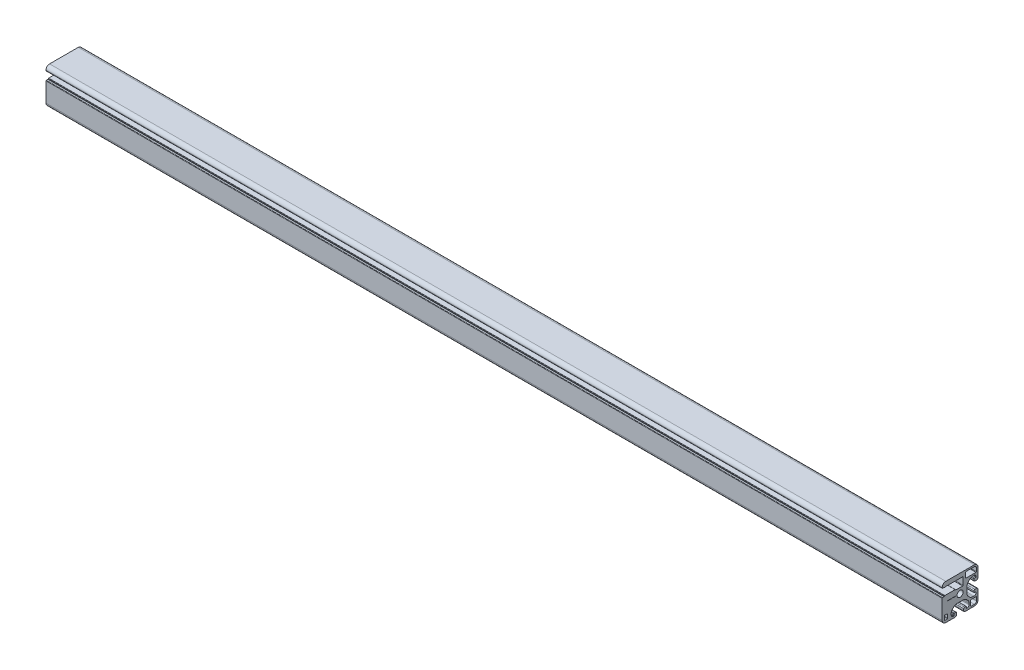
SolidWorks part; units mm, degrees
ref_plane "Ebene vorne" through (0, 0, 0) normal (0, 0, 1) x (1, 0, 0)
ref_plane "Ebene oben" through (0, 0, 0) normal (0, 1, 0) x (1, 0, 0)
ref_plane "Ebene rechts" through (0, 0, 0) normal (1, 0, 0) x (0, 0, -1)
sketch "Skizze1" plane through (0, 0, 0) normal (0, 1, 0) x (1, 0, 0)
  line L0 (0, 0) -> (1000, 0)
  dimension "D1" = 1000
other "Strukturbauteil1"
ref_plane "Ebene1" through (0, 0, 0) normal (1, 0, 0) x (0, 0, -1)
sketch "Model" plane through (0, 0, 0) normal (1, 0, 0) x (0, 0, -1)
  line L0 (-19.97, 15.976) -> (-19.97, 15.4768)
  line L1 (-19.97, 5.4918) -> (-19.97, -15.976)
  line L2 (-15.976, -19.97) -> (-5.4918, -19.97)
  line L3 (5.4918, -19.97) -> (15.976, -19.97)
  line L4 (-17.3739, -16.675) -> (-17.3739, -11.9325)
  line L5 (-17.2741, 6.4399) -> (-17.2741, -11.4601)
  line L6 (12.2816, -18.1727) -> (15.976, -18.1727)
  line L7 (-14.3784, -17.1742) -> (-16.8747, -17.1742)
  line L8 (6.4903, -15.4768) -> (4.9925, -15.4768)
  line L9 (-4.9925, -15.4768) -> (-6.4903, -15.4768)
  line L10 (-13.979, -11.4601) -> (-13.979, -0.0504)
  line L11 (-13.8792, -0.4993) -> (-13.8792, -11.4601)
  line L12 (-16.9745, -12.2321) -> (-14.2786, -12.2321)
  line L13 (17.6735, -11.7823) -> (12.2816, -11.7823)
  line L14 (-9.985, -15.4768) -> (-9.985, -14.1711)
  line L15 (15.4768, -9.985) -> (14.1711, -9.985)
  line L16 (-3.5523, -7.7384) -> (3.5523, -7.7384)
  line L17 (-6.9895, -15.976) -> (-6.9895, -17.4738)
  line L18 (15.976, -6.9895) -> (17.4738, -6.9895)
  line L19 (-5.2921, 0.5487) -> (-5.2921, 6.4399)
  line L20 (-4.9925, 5.4918) -> (-4.9925, 0.4993)
  line L21 (-3.994, -18.4723) -> (-3.994, -16.4753)
  line L22 (18.4723, -3.994) -> (16.4753, -3.994)
  line L23 (-5.4918, 0) -> (-13.3799, 0)
  line L24 (-13.6795, 0.2492) -> (-5.5916, 0.2492)
  line L25 (7.0825, -9.2006) -> (8.5227, -10.6409)
  line L26 (-8.5227, -10.6409) -> (-7.0825, -9.2006)
  line L27 (9.2006, 7.0825) -> (10.6409, 8.5227)
  line L28 (10.6409, -8.5227) -> (9.2006, -7.0825)
  line L29 (3.2951, 14.4783) -> (3.2951, 6.4903)
  line L30 (3.994, -16.4753) -> (3.994, -18.4723)
  line L31 (16.4753, 3.994) -> (18.4723, 3.994)
  line L32 (6.2906, 17.6735) -> (6.2906, 12.2816)
  line L33 (6.9895, -17.4738) -> (6.9895, -15.976)
  line L34 (7.7384, -3.5523) -> (7.7384, 3.5523)
  line L35 (2.7958, 5.991) -> (-4.4933, 5.991)
  line L36 (-17.8732, 5.991) -> (-19.4708, 5.991)
  line L37 (-5.5916, 6.7394) -> (-16.9745, 6.7394)
  line L38 (17.4738, 6.9895) -> (15.976, 6.9895)
  line L39 (9.985, -14.1711) -> (9.985, -15.4768)
  line L40 (14.1711, 9.985) -> (15.4768, 9.985)
  line L41 (11.7823, -12.2816) -> (11.7823, -17.6735)
  line L42 (6.7898, 11.7823) -> (17.6735, 11.7823)
  line L43 (-19.4708, 14.9775) -> (-17.2741, 14.9775)
  line L44 (-16.675, 14.9775) -> (-14.2786, 14.9775)
  line L45 (-13.6795, 14.9775) -> (-11.2831, 14.9775)
  line L46 (-10.684, 14.9775) -> (-8.2876, 14.9775)
  line L47 (-7.6885, 14.9775) -> (-5.2921, 14.9775)
  line L48 (-4.693, 14.9775) -> (2.7958, 14.9775)
  line L49 (15.4768, 6.4903) -> (15.4768, 4.9925)
  line L50 (15.4768, -4.9925) -> (15.4768, -6.4903)
  line L51 (18.1727, -15.976) -> (18.1727, -12.2816)
  line L52 (18.1727, 12.2816) -> (18.1727, 15.976)
  line L53 (15.976, 18.1727) -> (6.7898, 18.1727)
  line L54 (19.97, -15.976) -> (19.97, -5.4918)
  line L55 (19.97, 5.4918) -> (19.97, 15.976)
  line L56 (15.976, 19.97) -> (-15.976, 19.97)
  line L57 (-13.979, -11.9325) -> (-13.8792, -11.9325)
  line L58 (-19.97, -19.97) -> (19.97, -19.97) construction
  line L59 (-19.97, -19.97) -> (-19.97, 19.97) construction
  line L60 (-19.97, 19.97) -> (19.97, 19.97) construction
  line L61 (19.97, -19.97) -> (19.97, 19.97) construction
  line L62 (0, 19.97) -> (0, -19.97) construction
  line L63 (-19.97, 0) -> (19.97, 0) construction
  line L64 (-17.2741, -11.9325) -> (-17.3739, -11.9325)
  line L65 (-17.3739, -11.4601) -> (-17.2741, -11.4601)
  line L66 (-13.979, -11.4601) -> (-13.8792, -11.4601)
  line L67 (-13.8792, -11.9325) -> (-13.8792, -16.675)
  line L68 (-17.3739, -11.4601) -> (-17.3739, 5.4918)
  arc A0 (-3.5523, -7.7384) -> (-7.0825, -9.2006) centre (-3.5523, -12.7309) ccw
  arc A1 (-8.5227, -10.6409) -> (-9.985, -14.1711) centre (-4.9925, -14.1711) ccw
  arc A2 (-19.97, -15.976) -> (-15.976, -19.97) centre (-15.976, -15.976) ccw
  arc A3 (-9.985, -15.4768) -> (-7.4888, -17.973) centre (-7.4888, -15.4768) ccw
  arc A4 (-5.4918, -19.97) -> (-3.994, -18.4723) centre (-5.4918, -18.4723) ccw
  arc A5 (-3.994, -16.4753) -> (-4.9925, -15.4768) centre (-4.9925, -16.4753) ccw
  arc A6 (-7.4888, -17.973) -> (-6.9895, -17.4738) centre (-7.4888, -17.4738) ccw
  arc A7 (-6.4903, -15.4768) -> (-6.9895, -15.976) centre (-6.4903, -15.976) ccw
  arc A8 (-17.3739, -16.675) -> (-16.8747, -17.1742) centre (-16.8747, -16.675) ccw
  arc A9 (-14.3784, -17.1742) -> (-13.8792, -16.675) centre (-14.3784, -16.675) ccw
  arc A10 (-13.3799, 0) -> (-13.8792, -0.4993) centre (-13.3799, -0.4993) ccw
  arc A11 (-14.2786, -12.2321) -> (-13.979, -11.9325) centre (-14.2786, -11.9325) ccw
  arc A12 (-17.2741, -11.9325) -> (-16.9745, -12.2321) centre (-16.9745, -11.9325) ccw
  arc A13 (-15.976, 19.97) -> (-19.97, 15.976) centre (-15.976, 15.976) ccw
  arc A14 (-19.4708, 5.991) -> (-19.97, 5.4918) centre (-19.4708, 5.4918) ccw
  arc A15 (-17.3739, 5.4918) -> (-17.8732, 5.991) centre (-17.8732, 5.4918) ccw
  arc A16 (-5.4918, 0) -> (-4.9925, 0.4993) centre (-5.4918, 0.4993) ccw
  arc A17 (-4.4933, 5.991) -> (-4.9925, 5.4918) centre (-4.4933, 5.4918) ccw
  arc A18 (-19.97, 15.4768) -> (-19.4708, 14.9775) centre (-19.4708, 15.4768) ccw
  arc A19 (-13.6795, 0.2492) -> (-13.979, -0.0504) centre (-13.6795, -0.0504) ccw
  arc A20 (-16.9745, 6.7394) -> (-17.2741, 6.4399) centre (-16.9745, 6.4399) ccw
  arc A21 (-5.2921, 6.4399) -> (-5.5916, 6.7394) centre (-5.5916, 6.4399) ccw
  arc A22 (-5.5916, 0.2492) -> (-5.2921, 0.5487) centre (-5.5916, 0.5487) ccw
  arc A23 (-5.2921, 14.9775) -> (-4.693, 14.9775) centre (-4.9925, 14.9775) ccw
  arc A24 (-8.2876, 14.9775) -> (-7.6885, 14.9775) centre (-7.988, 14.9775) ccw
  arc A25 (-11.2831, 14.9775) -> (-10.684, 14.9775) centre (-10.9835, 14.9775) ccw
  arc A26 (-14.2786, 14.9775) -> (-13.6795, 14.9775) centre (-13.979, 14.9775) ccw
  arc A27 (-17.2741, 14.9775) -> (-16.675, 14.9775) centre (-16.9745, 14.9775) ccw
  arc A28 (7.7384, -3.5523) -> (9.2006, -7.0825) centre (12.7309, -3.5523) ccw
  arc A29 (10.6409, -8.5227) -> (14.1711, -9.985) centre (14.1711, -4.9925) ccw
  arc A30 (9.985, -14.1711) -> (8.5227, -10.6409) centre (4.9925, -14.1711) ccw
  arc A31 (7.0825, -9.2006) -> (3.5523, -7.7384) centre (3.5523, -12.7309) ccw
  arc A32 (15.976, -19.97) -> (19.97, -15.976) centre (15.976, -15.976) ccw
  arc A33 (15.4768, -9.985) -> (17.973, -7.4888) centre (15.4768, -7.4888) ccw
  arc A34 (7.4888, -17.973) -> (9.985, -15.4768) centre (7.4888, -15.4768) ccw
  arc A35 (15.976, -18.1727) -> (18.1727, -15.976) centre (15.976, -15.976) ccw
  arc A36 (19.97, -5.4918) -> (18.4723, -3.994) centre (18.4723, -5.4918) ccw
  arc A37 (3.994, -18.4723) -> (5.4918, -19.97) centre (5.4918, -18.4723) ccw
  arc A38 (16.4753, -3.994) -> (15.4768, -4.9925) centre (16.4753, -4.9925) ccw
  arc A39 (4.9925, -15.4768) -> (3.994, -16.4753) centre (4.9925, -16.4753) ccw
  arc A40 (17.973, -7.4888) -> (17.4738, -6.9895) centre (17.4738, -7.4888) ccw
  arc A41 (15.4768, -6.4903) -> (15.976, -6.9895) centre (15.976, -6.4903) ccw
  arc A42 (6.9895, -15.976) -> (6.4903, -15.4768) centre (6.4903, -15.976) ccw
  arc A43 (6.9895, -17.4738) -> (7.4888, -17.973) centre (7.4888, -17.4738) ccw
  arc A44 (18.1727, -12.2816) -> (17.6735, -11.7823) centre (17.6735, -12.2816) ccw
  arc A45 (12.2816, -11.7823) -> (11.7823, -12.2816) centre (12.2816, -12.2816) ccw
  arc A46 (11.7823, -17.6735) -> (12.2816, -18.1727) centre (12.2816, -17.6735) ccw
  arc A47 (14.1711, 9.985) -> (10.6409, 8.5227) centre (14.1711, 4.9925) ccw
  arc A48 (9.2006, 7.0825) -> (7.7384, 3.5523) centre (12.7309, 3.5523) ccw
  arc A49 (19.97, 15.976) -> (15.976, 19.97) centre (15.976, 15.976) ccw
  circle A50 centre (0, 0) radius 3.3949
  arc A51 (17.973, 7.4888) -> (15.4768, 9.985) centre (15.4768, 7.4888) ccw
  arc A52 (18.1727, 15.976) -> (15.976, 18.1727) centre (15.976, 15.976) ccw
  arc A53 (18.4723, 3.994) -> (19.97, 5.4918) centre (18.4723, 5.4918) ccw
  arc A54 (15.4768, 4.9925) -> (16.4753, 3.994) centre (16.4753, 4.9925) ccw
  arc A55 (2.7958, 5.991) -> (3.2951, 6.4903) centre (2.7958, 6.4903) ccw
  arc A56 (3.2951, 14.4783) -> (2.7958, 14.9775) centre (2.7958, 14.4783) ccw
  arc A57 (15.976, 6.9895) -> (15.4768, 6.4903) centre (15.976, 6.4903) ccw
  arc A58 (17.4738, 6.9895) -> (17.973, 7.4888) centre (17.4738, 7.4888) ccw
  arc A59 (17.6735, 11.7823) -> (18.1727, 12.2816) centre (17.6735, 12.2816) ccw
  arc A60 (6.7898, 18.1727) -> (6.2906, 17.6735) centre (6.7898, 17.6735) ccw
  arc A61 (6.2906, 12.2816) -> (6.7898, 11.7823) centre (6.7898, 12.2816) ccw
  point P183 (-19.97, 19.97)
  point P184 (0, 19.97)
  point P185 (19.97, 19.97)
  point P189 (19.97, 0)
  point P190 (19.97, -19.97)
  point P191 (0, -19.97)
  point P192 (-19.97, -19.97)
  point P193 (-19.97, 0)
  point P194 (0, 0)
  point P200 (0, 0)
